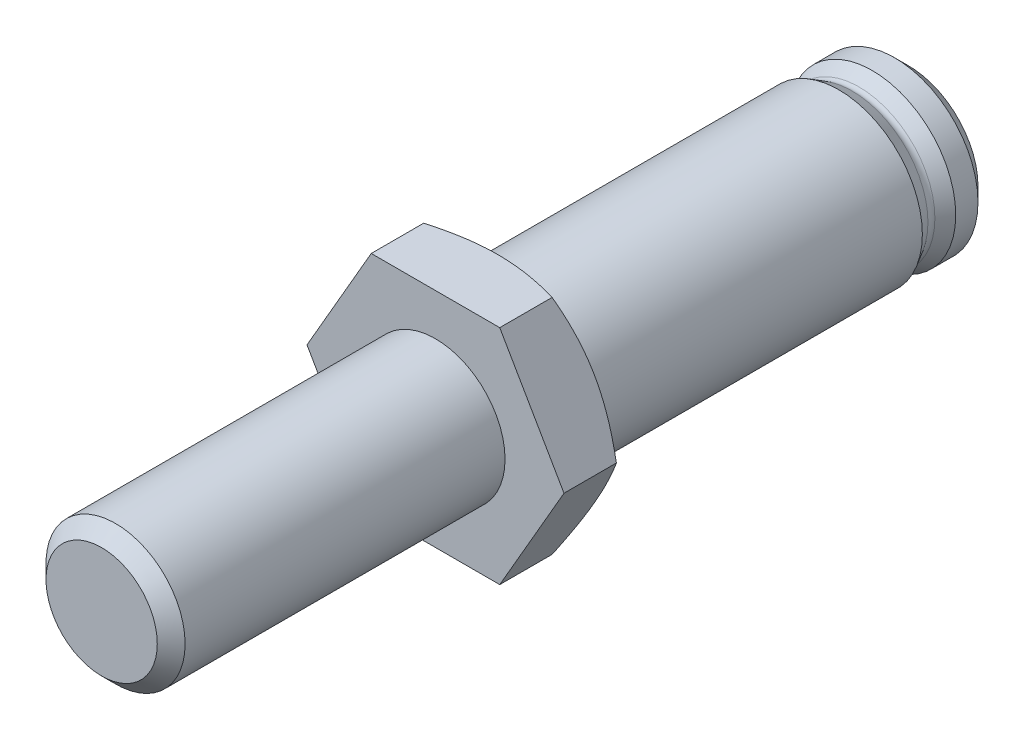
SolidWorks part; units mm, degrees
ref_plane "Face" through (0, 0, 0) normal (0, 0, 1) x (1, 0, 0)
ref_plane "Dessus" through (0, 0, 0) normal (0, 1, 0) x (1, 0, 0)
ref_plane "Droite" through (0, 0, 0) normal (1, 0, 0) x (0, 0, -1)
sketch "Esquisse1" plane through (0, 0, 0) normal (0, 0, 1) x (1, 0, 0)
  line L1 (4.6188, 0) -> (2.3094, 4)
  line L2 (2.3094, 4) -> (-2.3094, 4)
  line L3 (-2.3094, 4) -> (-4.6188, 0)
  line L4 (-4.6188, 0) -> (-2.3094, -4)
  line L5 (-2.3094, -4) -> (2.3094, -4)
  line L6 (2.3094, -4) -> (4.6188, 0)
  circle A0 centre (0, 0) radius 4 construction
  dimension "D1" = 8
extrude "Extrusion1" add sketch "Esquisse1" against normal blind 17
sketch "Esquisse3" plane through (0, 0, 0) normal (1, 0, 0) x (0, 0, -1)
  line L0 (1.7634, 4.8258) -> (2.5, 3.55)
  line L1 (2.5, 3.55) -> (2.5, 3)
  line L2 (2.5, 3) -> (14.5, 3)
  line L3 (14.5, 3) -> (14.975, 2.7258)
  line L4 (-0.46, 0) -> (13.1944, 0) construction
  line L5 (15.225, 2.7258) -> (15.7, 3)
  line L8 (15.7, 3) -> (17.7019, 3)
  line L9 (17.7019, 3) -> (17.7019, 5.1184)
  line L10 (17.7019, 5.1184) -> (1.7634, 5.1184)
  line L11 (1.7634, 5.1184) -> (1.7634, 4.8258)
  arc A0 (15.225, 2.7258) -> (14.975, 2.7258) centre (15.1, 2.9423) cw
  point P14 (15.1, 2.6536)
  dimension "D1" = 30
  dimension "D6" = 6
  dimension "D7" = 2.5
  dimension "D9" = 0.25
  dimension "D2" = 30
  dimension "D3" = 0.6
  dimension "D4" = 0.6
  dimension "D5" = 12
  dimension "D8" = 30
revolve "Enlèvement de matière-Révolution1" cut sketch "Esquisse3" angle 360 about L4
sketch "Esquisse4" plane through (0, 0, 0) normal (0, 0, 1) x (1, 0, 0)
  circle A0 centre (0, 0) radius 2.5
  dimension "D1" = 5
extrude "Extrusion2" add sketch "Esquisse4" along normal blind 12
chamfer "Chanfrein1" distance 0.5 angle 45
chamfer "Chanfrein2" distance 0.5 angle 45
